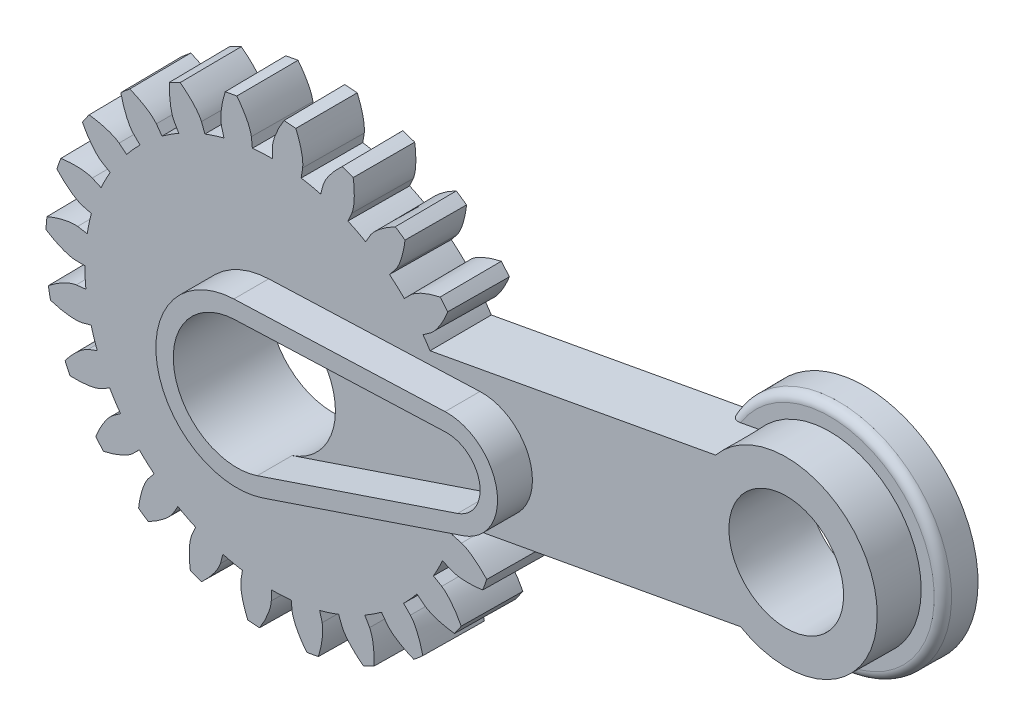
SolidWorks part; units mm, degrees
other "Solido1"
ref_plane "前视基准面" through (0, 0, 0) normal (0, 0, 1) x (1, 0, 0)
ref_plane "上视基准面" through (0, 0, 0) normal (0, 1, 0) x (1, 0, 0)
ref_plane "右视基准面" through (0, 0, 0) normal (1, 0, 0) x (0, 0, -1)
imported_body "Imported1"
sketch "Sketch1" plane through (0, 0, -0.5) normal (0, 0, -1) x (-1, 0, 0)
  circle A0 centre (0, 0) radius 4.5
  dimension "D1" = 9
extrude "Extrude1" cut sketch "Sketch1" against normal up to surface (1 mm away)
sketch "Sketch2" plane through (0, 0, 4) normal (0, 0, 1) x (1, 0, 0)
  circle A0 centre (0, 0) radius 3.65
  dimension "D1" = 7.3
extrude "Extrude2" cut sketch "Sketch2" against normal through all
sketch "Sketch3" plane through (0, 0, 4) normal (0, 0, 1) x (1, 0, 0)
  line L0 (0, 0) -> (12.0488, 2.2114) construction
  line L1 (25.4571, 8.708) -> (9.0773, 5.7017) construction
  line L2 (-0.1393, 3.6473) -> (11.9763, 4.11)
  line L3 (12.6552, 0.4107) -> (1.165, -3.4591)
  line L4 (-0.1774, 4.6466) -> (11.9381, 5.1092)
  line L5 (12.9744, -0.537) -> (1.4842, -4.4068)
  arc A0 (-0.1393, 3.6473) -> (1.165, -3.4591) centre (0, 0) ccw
  arc A1 (12.6552, 0.4107) -> (11.9763, 4.11) centre (12.0488, 2.2114) ccw
  arc A2 (12.9744, -0.537) -> (11.9381, 5.1092) centre (12.0488, 2.2114) ccw
  arc A3 (-0.1774, 4.6466) -> (1.4842, -4.4068) centre (0, 0) ccw
  dimension "D1" = 7.3
  dimension "D2" = 3.8
  dimension "D3" = 12.25
  dimension "D4" = 1
extrude "Extrude3" add sketch "Sketch3" along normal blind 2 contours L2 A1 L3 A0
